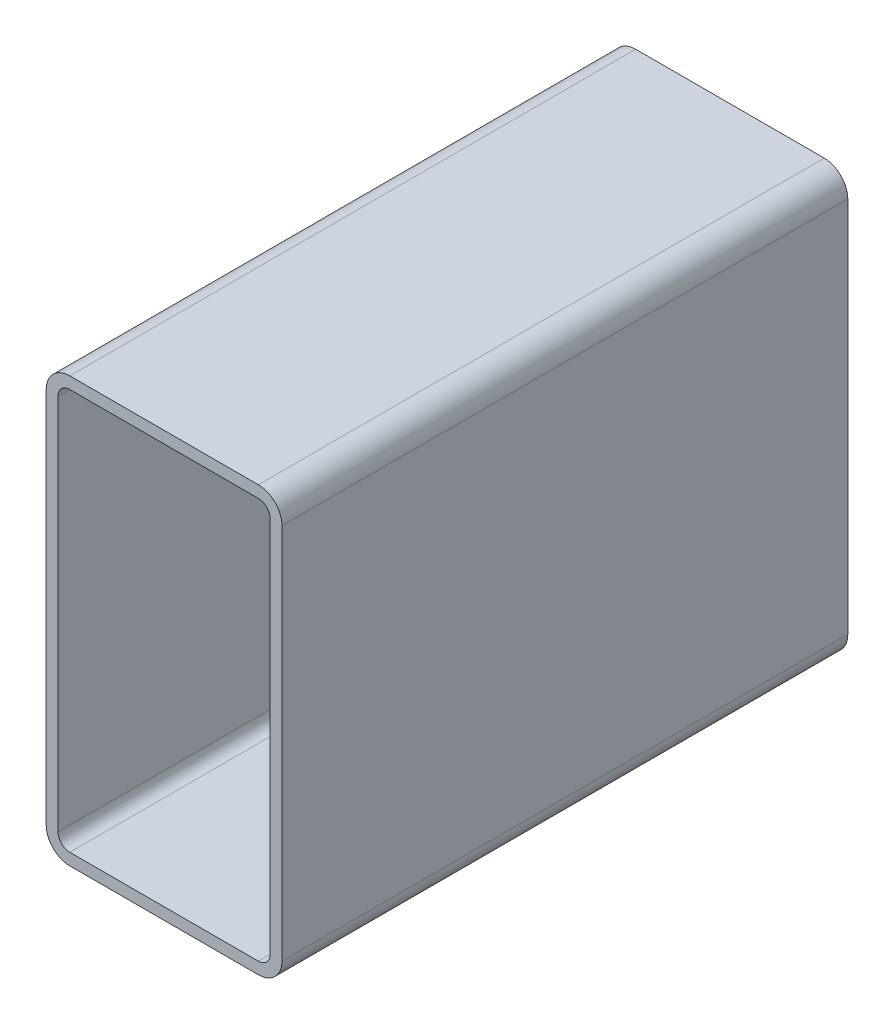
SolidWorks part; units mm, degrees
ref_plane "Front Plane" through (0, 0, 0) normal (0, 0, 1) x (1, 0, 0)
ref_plane "Top Plane" through (0, 0, 0) normal (0, 1, 0) x (1, 0, 0)
ref_plane "Right Plane" through (0, 0, 0) normal (1, 0, 0) x (0, 0, -1)
sketch "Sketch1" plane through (0, 0, 0) normal (0, 0, 1) x (1, 0, 0)
sketch_block_instance "HSS9x5x0.250-1"
sketch_block "HSS9x5x0.250"
extrude "Boss-Extrude2" add sketch "Sketch1" along normal blind 304.8
